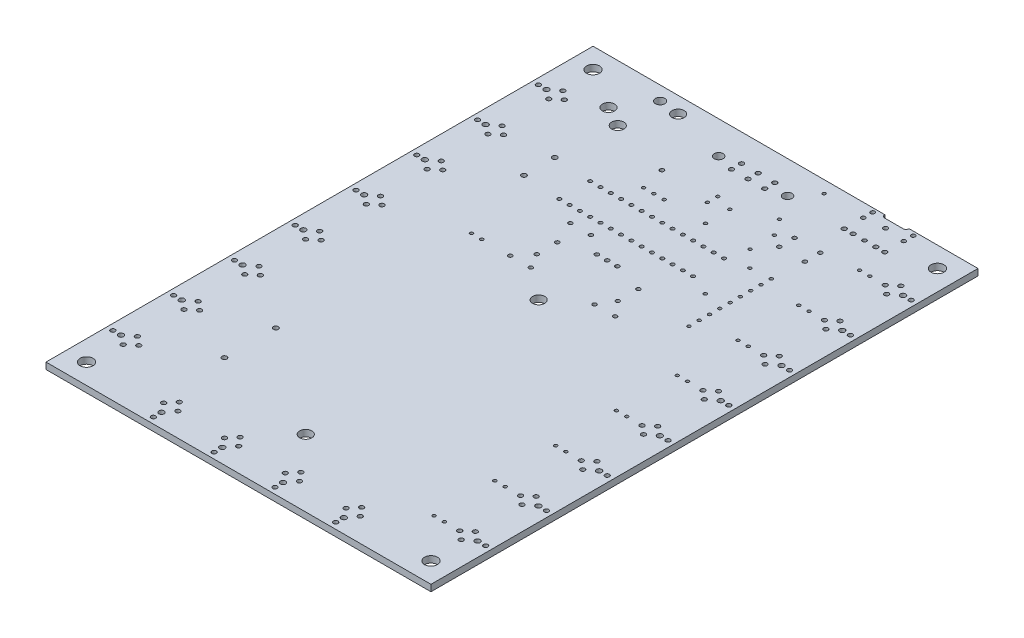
SolidWorks part; units mm, degrees
ref_plane "Plan de face" through (0, 0, 0) normal (0, 0, 1) x (1, 0, 0)
ref_plane "Plan de dessus" through (0, 0, 0) normal (0, 1, 0) x (1, 0, 0)
ref_plane "Plan de droite" through (0, 0, 0) normal (1, 0, 0) x (0, 0, -1)
sketch "Esquisse1" plane through (0, 0, 0) normal (0, 1, 0) x (1, 0, 0)
  line L0 (72.7481, 134.2517) -> (77.249, 134.2517)
  line L1 (0, 0) -> (95, 0)
  line L2 (0, 0) -> (0, 135)
  line L3 (0, 135) -> (71.9988, 135)
  line L4 (95, 0) -> (95, 135)
  line L5 (77.9983, 135) -> (95, 135)
  circle A0 centre (24.9987, 1.4986) radius 0.5512
  circle A1 centre (24.9987, 7.8994) radius 0.5512
  circle A2 centre (26.7487, 5.7988) radius 0.5512
  circle A3 centre (23.2486, 5.7988) radius 0.5512
  circle A4 centre (24.9987, 3.5001) radius 0.6502
  circle A5 centre (39.9999, 1.4986) radius 0.5512
  circle A6 centre (39.9999, 7.8994) radius 0.5512
  circle A7 centre (41.75, 5.7988) radius 0.5512
  circle A8 centre (38.2499, 5.7988) radius 0.5512
  circle A9 centre (39.9999, 3.5001) radius 0.6502
  circle A10 centre (54.9986, 1.4986) radius 0.5512
  circle A11 centre (54.9986, 7.8994) radius 0.5512
  circle A12 centre (56.7487, 5.7988) radius 0.5512
  circle A13 centre (53.2486, 5.7988) radius 0.5512
  circle A14 centre (54.9986, 3.5001) radius 0.6502
  circle A15 centre (69.9999, 1.4986) radius 0.5512
  circle A16 centre (69.9999, 7.8994) radius 0.5512
  circle A17 centre (71.7499, 5.7988) radius 0.5512
  circle A18 centre (68.2498, 5.7988) radius 0.5512
  circle A19 centre (69.9999, 3.5001) radius 0.6502
  circle A20 centre (21.0795, 35.6489) radius 0.5994
  circle A21 centre (21.0795, 22.9489) radius 0.5994
  circle A23 centre (47.5005, 16.5989) radius 1.5011
  circle A24 centre (72.1741, 118.905) radius 0.5004
  circle A25 centre (72.1741, 115.095) radius 0.5004
  circle A26 centre (65.8241, 115.095) radius 0.5004
  circle A27 centre (65.8241, 118.905) radius 0.5004
  circle A28 centre (40.0939, 94.3864) radius 0.4826
  circle A29 centre (35.0139, 94.3864) radius 0.4826
  circle A30 centre (60.452, 79.9922) radius 0.4826
  circle A31 centre (55.372, 79.9922) radius 0.4826
  circle A32 centre (34.5465, 80.0075) radius 0.4826
  circle A33 centre (39.6265, 80.0075) radius 0.4826
  circle A34 centre (57.5005, 83.599) radius 0.4826
  circle A35 centre (57.5005, 88.679) radius 0.4826
  circle A36 centre (37.5006, 83.599) radius 0.4826
  circle A37 centre (37.5006, 88.679) radius 0.4826
  circle A38 centre (20, 121.0996) radius 1.5011
  circle A39 centre (15.0012, 123.7996) radius 1.5011
  circle A40 centre (25.0012, 131.0005) radius 1.5011
  circle A41 centre (20, 131.5491) radius 1.1506
  circle A42 centre (19.0703, 98.8822) radius 0.5994
  circle A43 centre (19.0703, 106.5022) radius 0.5994
  circle A44 centre (5.0013, 5.0013) radius 1.6002
  circle A45 centre (5.0013, 129.9997) radius 1.6002
  circle A46 centre (89.9998, 129.9997) radius 1.6002
  circle A47 centre (89.9998, 5.0013) radius 1.6002
  circle A48 centre (61.5112, 105.8088) radius 0.4496
  circle A49 centre (58.9712, 105.8088) radius 0.4496
  circle A50 centre (56.4312, 105.8088) radius 0.4496
  circle A51 centre (53.8912, 105.8088) radius 0.4496
  circle A52 centre (51.3512, 105.8088) radius 0.4496
  circle A53 centre (48.8112, 105.8088) radius 0.4496
  circle A54 centre (46.2712, 105.8088) radius 0.4496
  circle A55 centre (43.7312, 105.8088) radius 0.4496
  circle A56 centre (41.1912, 105.8088) radius 0.4496
  circle A57 centre (38.6512, 105.8088) radius 0.4496
  circle A58 centre (36.1112, 105.8088) radius 0.4496
  circle A59 centre (33.5712, 105.8088) radius 0.4496
  circle A60 centre (31.0312, 105.8088) radius 0.4496
  circle A61 centre (28.4912, 105.8088) radius 0.4496
  circle A62 centre (28.4912, 98.1888) radius 0.4496
  circle A63 centre (31.0312, 98.1888) radius 0.4496
  circle A64 centre (33.5712, 98.1888) radius 0.4496
  circle A65 centre (36.1112, 98.1888) radius 0.4496
  circle A66 centre (38.6512, 98.1888) radius 0.4496
  circle A67 centre (41.1912, 98.1888) radius 0.4496
  circle A68 centre (43.7312, 98.1888) radius 0.4496
  circle A69 centre (46.2712, 98.1888) radius 0.4496
  circle A70 centre (48.8112, 98.1888) radius 0.4496
  circle A71 centre (51.3512, 98.1888) radius 0.4496
  circle A72 centre (53.8912, 98.1888) radius 0.4496
  circle A73 centre (56.4312, 98.1888) radius 0.4496
  circle A74 centre (58.9712, 98.1888) radius 0.4496
  circle A75 centre (61.5112, 98.1888) radius 0.4496
  circle A76 centre (1.4986, 15.0012) radius 0.5512
  circle A77 centre (7.8994, 15.0012) radius 0.5512
  circle A78 centre (5.7988, 13.2512) radius 0.5512
  circle A79 centre (5.7988, 16.7513) radius 0.5512
  circle A80 centre (3.5001, 15.0012) radius 0.6502
  circle A81 centre (1.4986, 29.9999) radius 0.5512
  circle A82 centre (7.8994, 29.9999) radius 0.5512
  circle A83 centre (5.7988, 28.2499) radius 0.5512
  circle A84 centre (5.7988, 31.75) radius 0.5512
  circle A85 centre (3.5001, 30.0025) radius 0.6502
  circle A86 centre (1.4986, 45.0012) radius 0.5512
  circle A87 centre (7.8994, 45.0012) radius 0.5512
  circle A88 centre (5.7988, 43.2511) radius 0.5512
  circle A89 centre (5.7988, 46.7512) radius 0.5512
  circle A90 centre (3.5001, 45.0012) radius 0.6502
  circle A91 centre (1.4986, 59.9999) radius 0.5512
  circle A92 centre (7.8994, 59.9999) radius 0.5512
  circle A93 centre (5.7988, 58.2498) radius 0.5512
  circle A94 centre (5.7988, 61.7499) radius 0.5512
  circle A95 centre (3.5001, 60.0024) radius 0.6502
  circle A96 centre (1.4986, 75.0011) radius 0.5512
  circle A97 centre (7.8994, 75.0011) radius 0.5512
  circle A98 centre (5.7988, 73.2511) radius 0.5512
  circle A99 centre (5.7988, 76.7512) radius 0.5512
  circle A100 centre (3.5001, 75.0011) radius 0.6502
  circle A101 centre (1.4986, 89.9998) radius 0.5512
  circle A102 centre (7.8994, 89.9998) radius 0.5512
  circle A103 centre (5.7988, 88.2498) radius 0.5512
  circle A104 centre (5.7988, 91.7499) radius 0.5512
  circle A105 centre (3.5001, 90.0024) radius 0.6502
  circle A106 centre (1.4986, 105.0011) radius 0.5512
  circle A107 centre (7.8994, 105.0011) radius 0.5512
  circle A108 centre (5.7988, 103.251) radius 0.5512
  circle A109 centre (5.7988, 106.7511) radius 0.5512
  circle A110 centre (3.5001, 105.0011) radius 0.6502
  circle A111 centre (1.4986, 119.9998) radius 0.5512
  circle A112 centre (7.8994, 119.9998) radius 0.5512
  circle A113 centre (5.7988, 118.2522) radius 0.5512
  circle A114 centre (5.7988, 121.7498) radius 0.5512
  circle A115 centre (3.5001, 120.0023) radius 0.6502
  circle A116 centre (25.0012, 79.9998) radius 0.3988
  circle A117 centre (27.5412, 79.9998) radius 0.3988
  circle A118 centre (74.9986, 132.1918) radius 0.5512
  circle A119 centre (79.9973, 126.9924) radius 0.5512
  circle A120 centre (77.7977, 126.9924) radius 0.5512
  circle A121 centre (72.197, 126.9924) radius 0.5512
  circle A122 centre (69.9973, 126.9924) radius 0.5512
  circle A123 centre (74.9986, 126.9924) radius 0.5004
  circle A124 centre (79.9973, 133.9926) radius 0.5004
  circle A125 centre (79.9973, 131.6914) radius 0.5004
  circle A126 centre (69.9973, 133.9926) radius 0.5004
  circle A127 centre (69.9973, 131.6914) radius 0.5004
  arc A129 (77.249, 134.2517) -> (77.9983, 135) centre (77.249, 135.001) ccw
  arc A130 (71.9988, 135) -> (72.7481, 134.2517) centre (72.7481, 135.001) ccw
  circle A133 centre (83.2891, 15.019) radius 0.3988
  circle A134 centre (80.7491, 15.019) radius 0.3988
  circle A135 centre (83.2891, 30.0177) radius 0.3988
  circle A136 centre (80.7491, 30.0177) radius 0.3988
  circle A137 centre (83.2891, 45.019) radius 0.3988
  circle A138 centre (80.7491, 45.019) radius 0.3988
  circle A139 centre (83.2891, 60.0177) radius 0.3988
  circle A140 centre (80.7491, 60.0177) radius 0.3988
  circle A141 centre (83.2891, 75.0189) radius 0.3988
  circle A142 centre (80.7491, 75.0189) radius 0.3988
  circle A143 centre (83.2891, 90.0176) radius 0.3988
  circle A144 centre (80.7491, 90.0176) radius 0.3988
  circle A145 centre (83.2891, 105.0188) radius 0.3988
  circle A146 centre (80.7491, 105.0188) radius 0.3988
  circle A147 centre (83.2891, 120.0175) radius 0.3988
  circle A148 centre (80.7491, 120.0175) radius 0.3988
  circle A149 centre (47.5005, 115.73) radius 0.3988
  circle A150 centre (47.5005, 118.27) radius 0.3988
  circle A151 centre (93.4999, 14.9987) radius 0.5512
  circle A152 centre (87.1017, 14.9987) radius 0.5512
  circle A153 centre (89.2023, 16.7488) radius 0.5512
  circle A154 centre (89.2023, 13.2486) radius 0.5512
  circle A155 centre (91.501, 14.9987) radius 0.6502
  circle A156 centre (93.4999, 29.9999) radius 0.5512
  circle A157 centre (87.1017, 29.9999) radius 0.5512
  circle A158 centre (89.2023, 31.75) radius 0.5512
  circle A159 centre (89.2023, 28.2499) radius 0.5512
  circle A160 centre (91.501, 29.9999) radius 0.6502
  circle A161 centre (93.4999, 44.9986) radius 0.5512
  circle A162 centre (87.1017, 44.9986) radius 0.5512
  circle A163 centre (89.2023, 46.7487) radius 0.5512
  circle A164 centre (89.2023, 43.2486) radius 0.5512
  circle A165 centre (91.501, 44.9986) radius 0.6502
  circle A166 centre (93.4999, 59.9999) radius 0.5512
  circle A167 centre (87.1017, 59.9999) radius 0.5512
  circle A168 centre (89.2023, 61.7499) radius 0.5512
  circle A169 centre (89.2023, 58.2498) radius 0.5512
  circle A170 centre (91.501, 59.9999) radius 0.6502
  circle A171 centre (93.4999, 74.9986) radius 0.5512
  circle A172 centre (87.1017, 74.9986) radius 0.5512
  circle A173 centre (89.2023, 76.7486) radius 0.5512
  circle A174 centre (89.2023, 73.2485) radius 0.5512
  circle A175 centre (91.501, 74.9986) radius 0.6502
  circle A176 centre (93.4999, 89.9998) radius 0.5512
  circle A177 centre (87.1017, 89.9998) radius 0.5512
  circle A178 centre (89.2023, 91.7499) radius 0.5512
  circle A179 centre (89.2023, 88.2498) radius 0.5512
  circle A180 centre (91.501, 89.9998) radius 0.6502
  circle A181 centre (93.4999, 104.9985) radius 0.5512
  circle A182 centre (87.1017, 104.9985) radius 0.5512
  circle A183 centre (89.2023, 106.7486) radius 0.5512
  circle A184 centre (89.2023, 103.2485) radius 0.5512
  circle A185 centre (91.501, 104.9985) radius 0.6502
  circle A186 centre (93.4999, 119.9998) radius 0.5512
  circle A187 centre (87.1017, 119.9998) radius 0.5512
  circle A188 centre (89.2023, 121.7498) radius 0.5512
  circle A189 centre (89.2023, 118.2497) radius 0.5512
  circle A190 centre (91.501, 119.9998) radius 0.6502
  circle A191 centre (36.4592, 111.0005) radius 0.3988
  circle A192 centre (38.9992, 111.0005) radius 0.3988
  circle A193 centre (41.5392, 111.0005) radius 0.3988
  circle A194 centre (66.7614, 95.9282) radius 0.3988
  circle A195 centre (66.7614, 106.9289) radius 0.3988
  circle A196 centre (59.9999, 121.0005) radius 0.3988
  circle A197 centre (59.9999, 132.0013) radius 0.3988
  circle A198 centre (51.75, 117) radius 0.3988
  circle A199 centre (62.7507, 117) radius 0.3988
  circle A200 centre (62.7507, 111.0005) radius 0.3988
  circle A201 centre (51.75, 111.0005) radius 0.3988
  circle A202 centre (50.0405, 90.9752) radius 0.5004
  circle A203 centre (47.5005, 90.9752) radius 0.5004
  circle A204 centre (44.9605, 90.9752) radius 0.5004
  circle A205 centre (47.5005, 74.074) radius 1.5011
  circle A206 centre (71.6991, 86.9671) radius 0.3988
  circle A207 centre (71.6991, 89.5071) radius 0.3988
  circle A208 centre (71.6991, 92.0471) radius 0.3988
  circle A209 centre (71.6991, 94.5871) radius 0.3988
  circle A210 centre (71.6991, 97.1271) radius 0.3988
  circle A211 centre (71.6991, 99.6671) radius 0.3988
  circle A212 centre (71.6991, 102.2071) radius 0.3988
  circle A213 centre (71.6991, 104.7471) radius 0.3988
  circle A214 centre (71.6991, 107.2871) radius 0.3988
  circle A215 centre (47.5005, 128.2497) radius 0.5512
  circle A216 centre (43.401, 128.2497) radius 0.5512
  circle A217 centre (47.5005, 125.7503) radius 0.5512
  circle A218 centre (43.401, 125.7503) radius 0.5512
  circle A219 centre (51.6001, 128.2497) radius 0.5512
  circle A220 centre (51.6001, 125.7503) radius 0.5512
  circle A221 centre (55.9994, 127) radius 1.0998
  circle A222 centre (38.9992, 127) radius 1.0998
  circle A223 centre (35.0012, 117) radius 0.5004
extrude "Extrusion1" add sketch "Esquisse1" along normal blind 1.6
